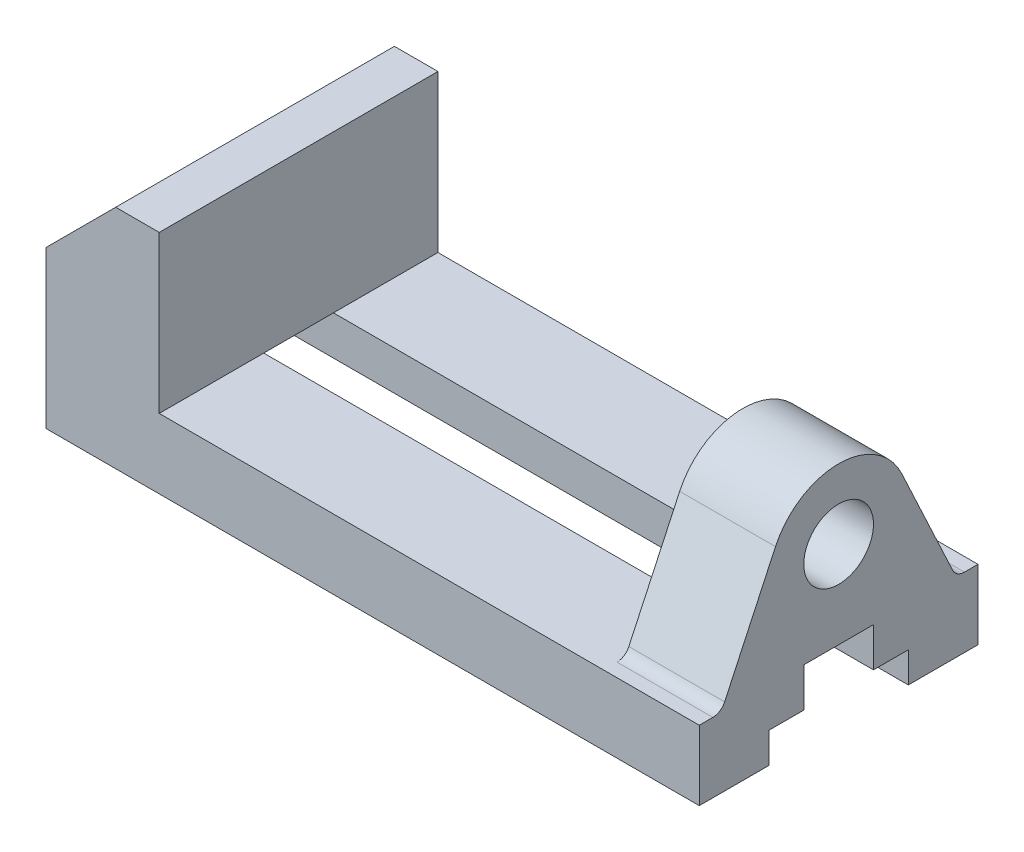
SolidWorks part; units mm, degrees
ref_plane "Front" through (0, 0, 0) normal (0, 0, 1) x (1, 0, 0)
ref_plane "Top" through (0, 0, 0) normal (0, 1, 0) x (1, 0, 0)
ref_plane "Right" through (0, 0, 0) normal (1, 0, 0) x (0, 0, -1)
sketch "Sketch1" plane through (0, 0, 0) normal (0, 0, 1) x (1, 0, 0)
  line L0 (0, 0) -> (150, 0)
  line L1 (150, 0) -> (150, 16)
  line L2 (150, 16) -> (26, 16)
  line L3 (26, 16) -> (26, 52)
  line L4 (26, 52) -> (16, 52)
  line L5 (16, 52) -> (0, 36)
  line L6 (0, 36) -> (0, 0)
  dimension "D1" = 150
  dimension "D2" = 16
  dimension "D3" = 10
  dimension "D4" = 16
  dimension "D5" = 16
  dimension "D6" = 36
extrude "Extrude1" add sketch "Sketch1" along normal mid plane 64
sketch "Sketch2" plane through (150, 0, 0) normal (1, 0, 0) x (0, 0, -1)
  line L0 (14.5009, 42.7619) -> (26.9802, 16)
  line L1 (-32, 52) -> (32, 52) construction
  line L2 (-32, 16) -> (32, 16) construction
  line L3 (0, 52.7641) -> (0, -22.9682) construction
  line L5 (-14.5009, 42.7619) -> (-26.9802, 16)
  line L7 (-26.9802, 16) -> (26.9802, 16)
  arc A1 (14.5009, 42.7619) -> (-14.5009, 42.7619) centre (0, 36) ccw
  dimension "D1" = 16
  dimension "D2" = 50
extrude "Extrude3" add sketch "Sketch2" against normal blind 22
fillet "Fillet1" radius 3 2 edges at (139, 16, -26.9802) (139, 16, 26.9802)
other "Hole1"
sketch "Sketch3" plane through (150, 0, 0) normal (1, 0, 0) x (0, 0, -1)
  circle A0 centre (0, 36) radius 8
  arc A1 (14.5009, 42.7619) -> (-14.5009, 42.7619) centre (0, 36) ccw construction
  dimension "D1" = 16
sketch "Sketch4" plane through (150, 0, 0) normal (1, 0, 0) x (0, 0, -1)
  line L0 (0, 0) -> (0, 54.7774) construction
  line L1 (-16, 0) -> (-16, 7)
  line L2 (-32, 0) -> (32, 0) construction
  line L3 (16, 0) -> (16, 7)
  line L4 (-16, 7) -> (-8, 7)
  line L5 (16, 7) -> (8, 7)
  line L6 (-8, 7) -> (-8, 16)
  line L7 (8, 7) -> (8, 16)
  line L8 (-8, 16) -> (8, 16)
  line L9 (-16, 0) -> (16, 0)
  point P14 (0, 16)
  dimension "D1" = 16
  dimension "D2" = 32
  dimension "D3" = 16
  dimension "D4" = 7
extrude "Cut-Extrude1" cut sketch "Sketch4" against normal through all
ref_plane "Plane1" through (0, 0, 22) normal (0, 0, 1) x (1, 0, 0)
sketch "Sketch6" plane through (0, 0, 22) normal (0, 0, 1) x (1, 0, 0)
  line L0 (112, 26.4839) -> (112, -16.0264) construction
  line L1 (150, 0) -> (150, 16) construction
  line L2 (112, 11.7321) -> (115, 10)
  line L3 (115, 10) -> (115, 0)
  line L4 (0, 0) -> (150, 0) construction
  line L5 (115, 0) -> (112, 0)
  line L6 (112, 0) -> (112, 11.7321)
  dimension "D1" = 38
  dimension "D2" = 6
  dimension "D3" = 10
  dimension "D4" = 60
revolve "Cut-Revolve1" cut sketch "Sketch6" angle 360 about L0
pattern_linear "LPattern2" count 2 spacing 70 along (-1, 0, 0) count 2 spacing 44 along (0, 0, -1) of "Cut-Revolve1"
sketch "Sketch7" plane through (0, 16, 0) normal (0, 1, 0) x (-1, 0, 0)
  ellipse E0 centre (-74.8282, 19.0243) end of major axis (-49.5999, 18.4376) minor radius 4.8493
